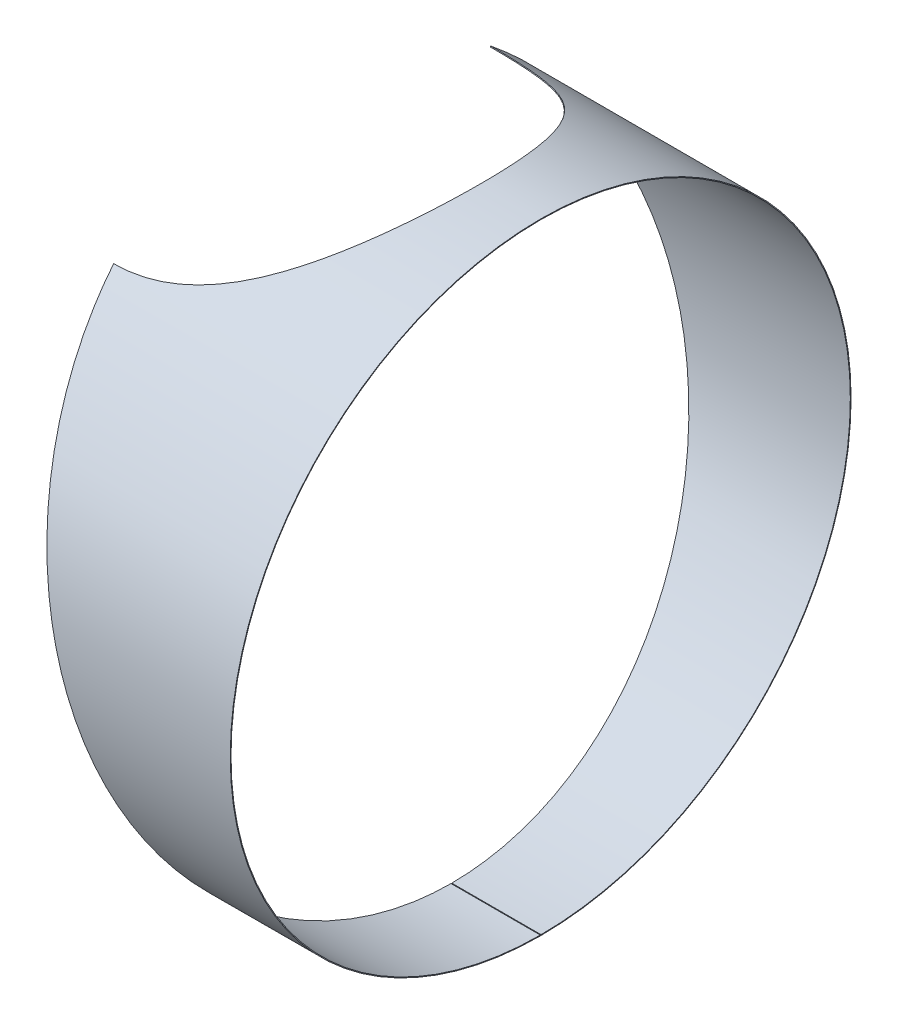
SolidWorks part; units mm, degrees
ref_plane "前视基准面" through (0, 0, 0) normal (0, 0, 1) x (1, 0, 0)
ref_plane "上视基准面" through (0, 0, 0) normal (0, 1, 0) x (1, 0, 0)
ref_plane "右视基准面" through (0, 0, 0) normal (1, 0, 0) x (0, 0, -1)
imported_body "基体零件-弯头节对接缝上平接分支管管-1"
sheet metal parameters "钣金1" parameters "D1"=0.7366, "厚度"=1
bend "圆角折弯1" bend radius 409 bend angle 359.86 parameters "D5"=1
flatten bends "展开-折弯1" parameters "D1"=0
sketch "尖角-草图1" plane through (-58.9489, 440.0003, 0.5) normal (0, -1, 0.0012) x (1, 0, 0)
  line L0 (-58.9489, 1284.4126) -> (58.9489, 1284.4126) construction
process bends "加工-折弯1" parameters "D1"=0
sketch "平面-草图1" plane through (-58.9489, 440.0003, 0.5) normal (0, -1, 0.0012) x (1, 0, 0)
